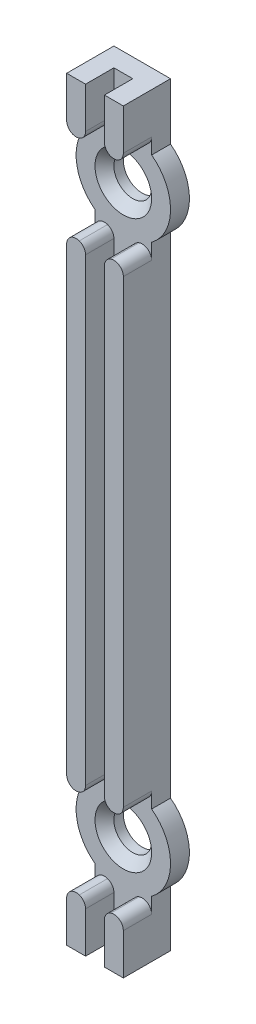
SolidWorks part; units mm, degrees
ref_plane "Plan de face" through (0, 0, 0) normal (0, 0, 1) x (1, 0, 0)
ref_plane "Plan de dessus" through (0, 0, 0) normal (0, 1, 0) x (1, 0, 0)
ref_plane "Plan de droite" through (0, 0, 0) normal (1, 0, 0) x (0, 0, -1)
sketch "Esquisse1" plane through (0, 0, 0) normal (0, 0, 1) x (1, 0, 0)
  line L1 (-9.1054, 40.2626) -> (-3.1054, 40.2626)
  line L2 (-9.1054, 40.2626) -> (-9.1054, -39.7374)
  line L3 (-9.1054, -39.7374) -> (-3.1054, -39.7374)
  line L4 (-3.1054, 40.2626) -> (-3.1054, -39.7374)
  circle A0 centre (-6.1054, -29.7374) radius 5
  circle A1 centre (-6.1054, 30.2626) radius 5
  circle A2 centre (-6.1054, -29.7374) radius 2
  circle A3 centre (-6.1054, 30.2626) radius 2
  dimension "D5" = 10
  dimension "D6" = 10
  dimension "D7" = 4
  dimension "D8" = 4
  dimension "D1" = 80
  dimension "D2" = 6
  dimension "D3" = 70
  dimension "D4" = 10
extrude "Boss.-Extru.1" add sketch "Esquisse1" along normal blind 5 contours A0 L2 L3 L4 | L2 A0 | L4 A0 L2 A2 | L4 A0 | L2 A1 | A1 L2 A0 L4 | A1 L4 L1 L2 | L4 A1 L2 A3 | L4 A1
sketch "Esquisse2" plane through (0, 0, 5) normal (0, 0, 1) x (1, 0, 0)
  line L0 (-9.1054, 40.2626) -> (-3.1054, 40.2626) construction
  line L1 (-7.1054, 40.2626) -> (-5.1054, 40.2626)
  line L2 (-7.1054, 40.2626) -> (-7.1054, -39.7374)
  line L3 (-7.1054, -39.7374) -> (-5.1054, -39.7374)
  line L4 (-5.1054, 40.2626) -> (-5.1054, -39.7374)
  line L5 (-9.1054, -39.7374) -> (-3.1054, -39.7374) construction
  circle A0 centre (-6.1054, 30.2626) radius 5
  circle A1 centre (-6.1054, -29.7374) radius 5
  dimension "D3" = 10
  dimension "D4" = 10
  dimension "D1" = 2
  dimension "D2" = 2
extrude "Enlèv. mat.-Extru.1" cut sketch "Esquisse2" against normal blind 3 contours A1 L4 A0 L2 | A1 L4 M12 | L2 A1 M8 | L4 A1 L2 | A1 L2 L4 M10 | A0 L4 M2 | L2 A0 M6 | L4 A0 L2 | A0 L4 L2 M4
sketch "Esquisse3" plane through (0, 0, 2) normal (0, 0, 1) x (1, 0, 0)
  circle A0 centre (-6.1054, 30.2626) radius 2
  circle A1 centre (-6.1054, -29.7374) radius 2
  dimension "D1" = 4
  dimension "D2" = 4
extrude "Enlèv. mat.-Extru.2" cut sketch "Esquisse3" against normal through all both and the other way through all
chamfer "Chanfrein1" distance 1 angle 45 2 edges at (-4.1054, -29.7374, 2) (-4.1054, 30.2626, 2)
fillet "Congé1" radius 1 10 edges at (-3.1054, 34.2626, 3.5) (-3.1054, 26.2626, 3.5) (-5.1054, 35.1616, 3.5) (-5.1054, 25.3636, 3.5) (-7.1054, 35.1616, 3.5) (-9.1054, 34.2626, 3.5) (-5.1054, -24.8384, 3.5) (-7.1054, -34.6364, 3.5) (-9.1054, -33.7374, 3.5) (-3.1054, -25.7374, 3.5)
